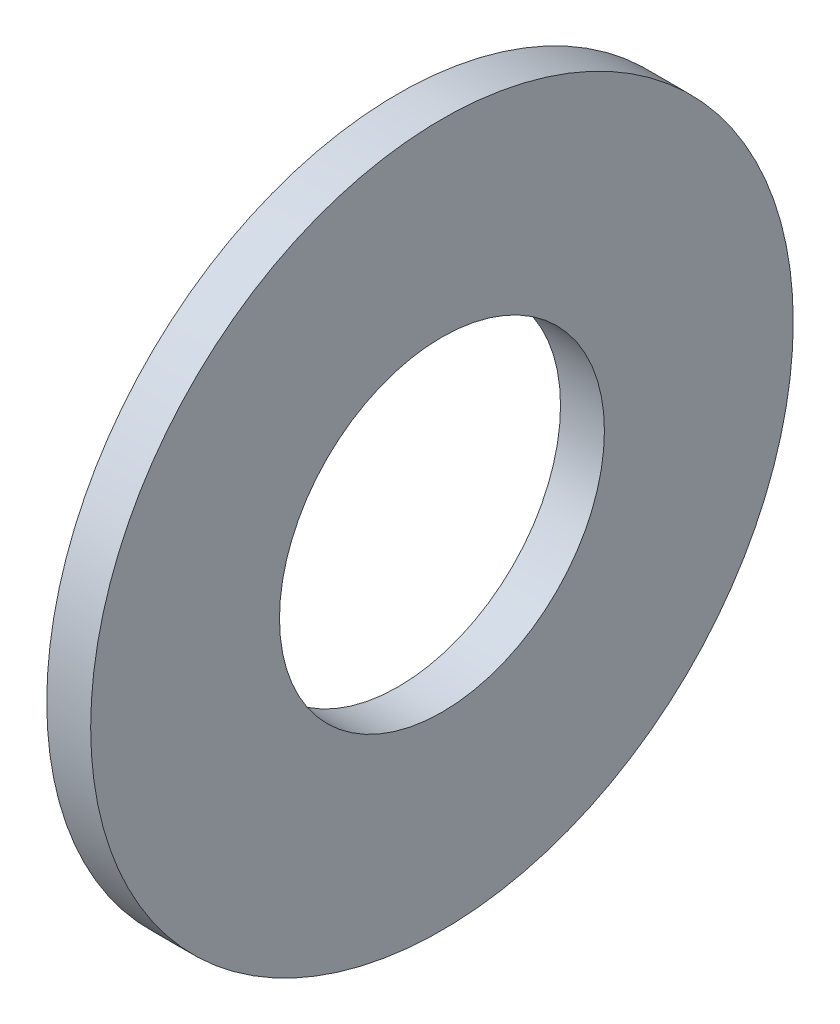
SolidWorks part; units mm, degrees
ref_plane "Plane1" through (0, 0, 0) normal (0, 0, 1) x (1, 0, 0)
ref_plane "Plane2" through (0, 0, 0) normal (0, 1, 0) x (1, 0, 0)
ref_plane "Plane3" through (0, 0, 0) normal (1, 0, 0) x (0, 0, -1)
revolve "Base-Revolve" add sketch "Sketch1" angle 360 about L0
sketch "Sketch1" plane through (0, 0, 0) normal (0, 0, 1) x (1, 0, 0)
  line L0 (-34.925, 0) -> (9.525, 0) construction
  line L1 (0, 1.85) -> (0, 4)
  line L2 (0, 4) -> (-0.5, 4)
  line L3 (-0.5, 4) -> (-0.5, 1.85)
  line L4 (-0.5, 1.85) -> (0, 1.85)
  dimension "Thickness" = 0.5
  dimension "Inside_dia" = 3.7
  dimension "Outside_dia" = 8
